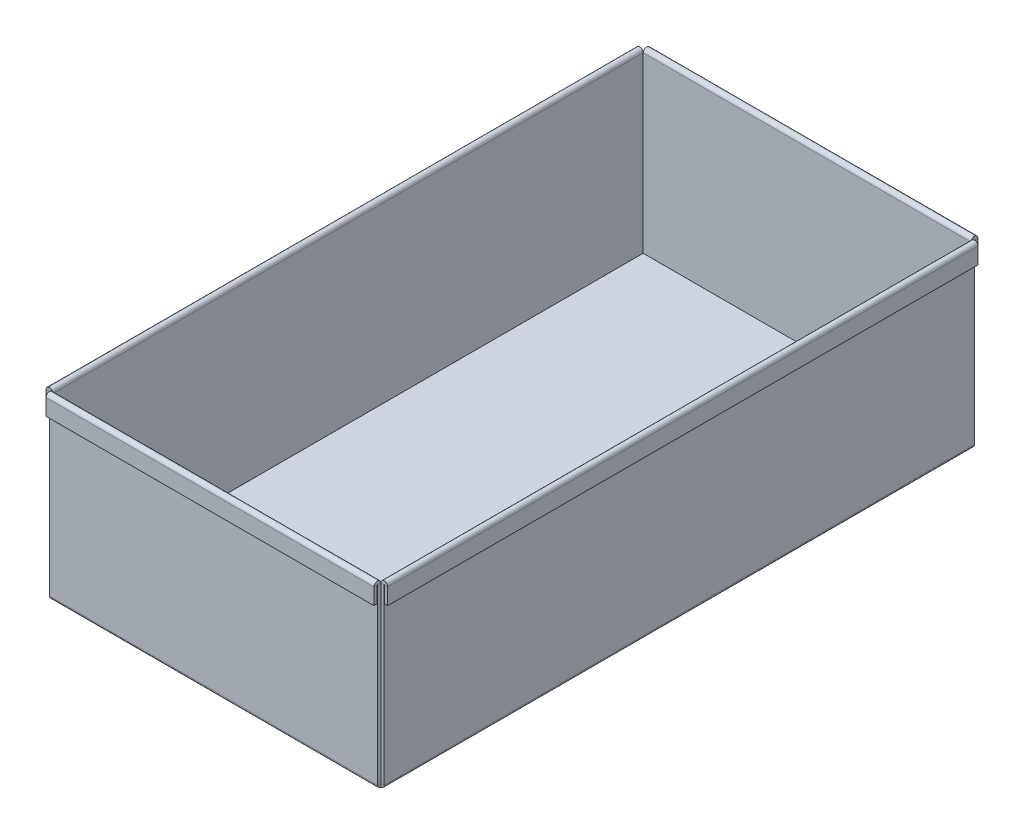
SolidWorks part; units mm, degrees
ref_plane "Front Plane" through (0, 0, 0) normal (0, 0, 1) x (1, 0, 0)
ref_plane "Top Plane" through (0, 0, 0) normal (0, 1, 0) x (1, 0, 0)
ref_plane "Right Plane" through (0, 0, 0) normal (1, 0, 0) x (0, 0, -1)
sketch "Sketch1" plane through (0, 0, 0) normal (0, 1, 0) x (1, 0, 0)
  line L0 (100, 180) -> (154, 180)
  line L1 (0, 0) -> (100, 0) construction
  line L2 (0, 0) -> (0, 180) construction
  line L3 (0, 180) -> (100, 180) construction
  line L4 (100, 0) -> (100, 180) construction
  line L5 (154, 180) -> (154, 0)
  line L6 (154, 0) -> (100, 0)
  line L7 (100, 0) -> (100, -54)
  line L8 (100, -54) -> (0, -54)
  line L9 (0, -54) -> (0, 0)
  line L10 (0, 0) -> (-54, 0)
  line L11 (-54, 0) -> (-54, 180)
  line L12 (-54, 180) -> (0, 180)
  line L13 (0, 180) -> (0, 234)
  line L14 (0, 234) -> (100, 234)
  line L15 (100, 234) -> (100, 180)
  dimension "D1" = 180
  dimension "D2" = 288
  dimension "D3" = 100
  dimension "D4" = 208
sheet metal parameters "Sheet-Metal1" thickness 1 parameters "D1"=1
base flange "Base-Flange1" sketch "Sketch1" thickness 1 reverse thickness direction yes parameters "D1"=1
sketch "Sketch3" plane through (0, 1, 0) normal (0, 1, 0) x (1, 0, 0)
  line L0 (0, 180) -> (100, 180)
  line L2 (100, 0) -> (0, 0)
sketched bend "Sketched Bend1" parameters "D1"=0.001
bend "SketchBend1" bend radius 0.001 bend angle 90 parameters "D5"=1
bend "SketchBend2" bend radius 0 bend angle 90 parameters "D5"=2
sketch "Sketch4" plane through (0, 1, 0) normal (0, 1, 0) x (1, 0, 0)
  line L0 (100, 180) -> (100, 0)
  line L1 (100, 0) -> (100, 180) construction
  line L2 (0, 180) -> (0, 0)
sketched bend "Sketched Bend2" parameters "D1"=0.001
bend "SketchBend3" bend radius 0.001 bend angle 90 parameters "D5"=3
bend "SketchBend4" bend radius 0 bend angle 90 parameters "D5"=4
hem "Hem1" parameters "D1"=0.25, "D7"=6, "D8"=0.1, "D9"=1
bend "HemBend1" bend radius 0.05 bend angle 180 parameters "D5"=5
bend "HemBend2" bend radius 0.05 bend angle 180 parameters "D5"=6
bend "HemBend3" bend radius 0.05 bend angle 180 parameters "D5"=7
bend "HemBend4" bend radius 0.05 bend angle 180 parameters "D5"=8
flat pattern "Flat-Pattern1"
sketch "Bend-Lines1" plane through (0, 0, 0) normal (0, 1, 0) x (-1, 0, 0)
bend of the flat pattern "Flatten-<SketchBend1>1"
bend of the flat pattern "Flatten-<SketchBend2>1"
bend of the flat pattern "Flatten-<SketchBend3>1"
bend of the flat pattern "Flatten-<SketchBend4>1"
bend of the flat pattern "Flatten-<HemBend1>1"
bend of the flat pattern "Flatten-<HemBend2>1"
bend of the flat pattern "Flatten-<HemBend3>1"
bend of the flat pattern "Flatten-<HemBend4>1"
